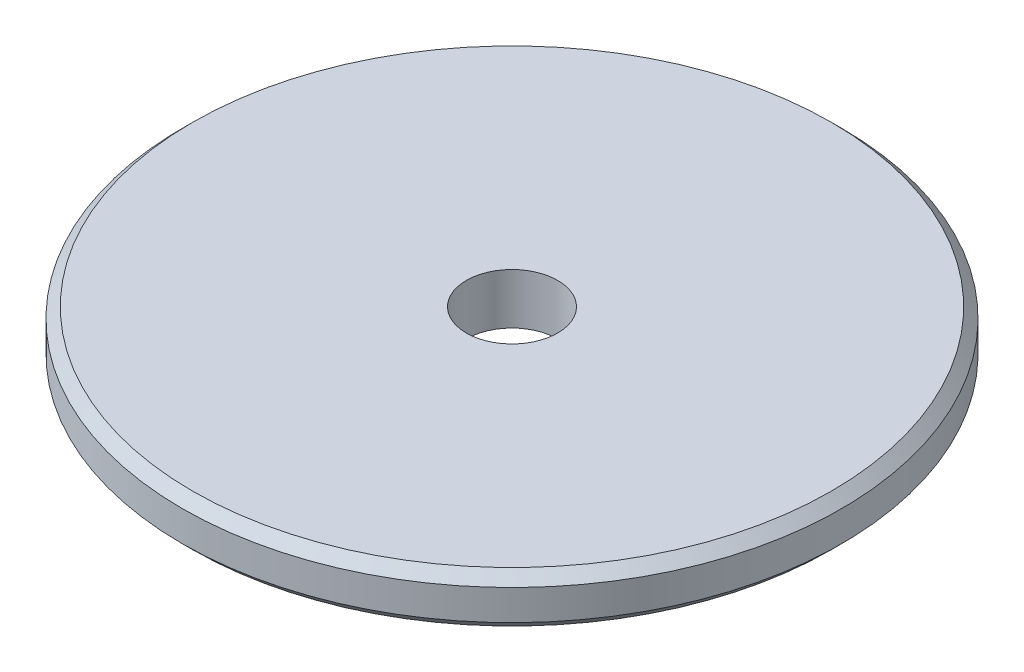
SolidWorks part; units mm, degrees
ref_plane "Front Plane" through (0, 0, 0) normal (0, 0, 1) x (1, 0, 0)
ref_plane "Top Plane" through (0, 0, 0) normal (0, 1, 0) x (1, 0, 0)
ref_plane "Right Plane" through (0, 0, 0) normal (1, 0, 0) x (0, 0, -1)
sketch "Sketch1" plane through (0, 0, 0) normal (0, 1, 0) x (1, 0, 0)
  circle A0 centre (0, 0) radius 32.5
  circle A1 centre (0, 0) radius 4.5
  dimension "D1" = 9
  dimension "D2" = 65
extrude "Extrude1" add sketch "Sketch1" along normal blind 5
chamfer "Chamfer1" distance 1 angle 45 2 edges at (0, 0, 32.5) (0, 5, 32.5)
